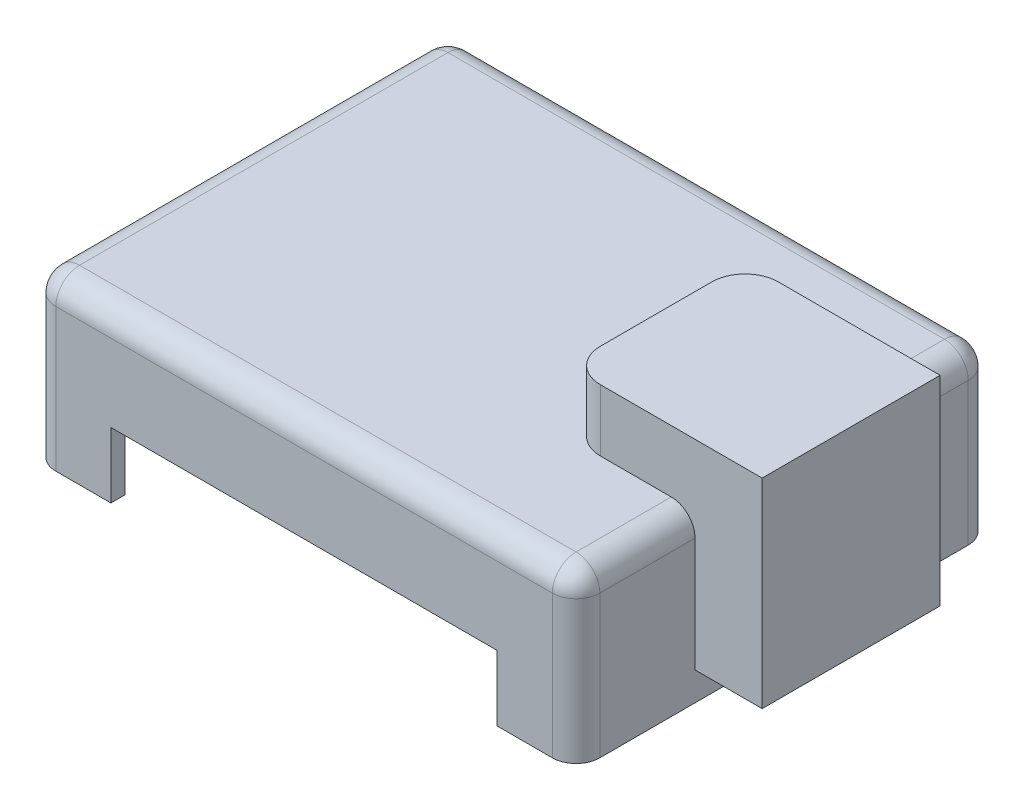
SolidWorks part; units mm, degrees
ref_plane "Front" through (0, 0, 0) normal (0, 0, 1) x (1, 0, 0)
ref_plane "Top" through (0, 0, 0) normal (0, 1, 0) x (1, 0, 0)
ref_plane "Right" through (0, 0, 0) normal (1, 0, 0) x (0, 0, -1)
ref_plane "Plane1" through (0, 0, 75.1895) normal (0, 0, 1) x (1, 0, 0)
sketch "Sketch1" plane through (0, 0, 0) normal (0, 1, 0) x (1, 0, 0)
  line L0 (57.2074, -43.7328) -> (-57.2074, 43.7328) construction
  line L1 (-57.2074, 43.7328) -> (57.2074, 43.7328)
  line L2 (-57.2074, 43.7328) -> (-57.2074, -43.7328)
  line L3 (-57.2074, -43.7328) -> (57.2074, -43.7328)
  line L4 (57.2074, 43.7328) -> (57.2074, -43.7328)
extrude "Extrude1" add sketch "Sketch1" along normal blind 35
fillet "Fillet1" radius 5 8 edges at (57.2074, 35, 0) (0, 35, -43.7328) (-57.2074, 35, 0) (0, 35, 43.7328) (-57.2074, 17.5, -43.7328) (57.2074, 17.5, -43.7328) (57.2074, 17.5, 43.7328) (-57.2074, 17.5, 43.7328)
shell "Shell1" thickness 3
sketch "Sketch2" plane through (0, 0, 43.7328) normal (0, 0, 1) x (1, 0, 0)
  line L0 (-52.2074, 0) -> (52.2074, 0) construction
  line L1 (-40.6196, 0) -> (40.6196, 0)
  line L2 (-40.6196, 0) -> (-40.6196, 13.761)
  line L3 (-40.6196, 13.761) -> (40.6196, 13.761)
  line L4 (40.6196, 0) -> (40.6196, 13.761)
extrude "Cut-Extrude1" cut sketch "Sketch2" against normal up to next
sketch "Sketch3" plane through (0, 35, 0) normal (0, 1, 0) x (-1, 0, 0)
  line L0 (0, 0) -> (-30.3006, 0) construction
  line L1 (-37.3006, -18.713) -> (-71.3184, -18.713)
  line L2 (-30.3006, -11.713) -> (-30.3006, 11.713)
  line L3 (-37.3006, 18.713) -> (-71.3184, 18.713)
  line L4 (-71.3184, -18.713) -> (-71.3184, 18.713)
  arc A0 (-37.3006, -18.713) -> (-30.3006, -11.713) centre (-37.3006, -11.713) ccw
  arc A1 (-30.3006, 11.713) -> (-37.3006, 18.713) centre (-37.3006, 11.713) ccw
  dimension "D1" = 7
extrude "Extrude2" add sketch "Sketch3" along normal blind 13 and the other way blind 29 separate body
